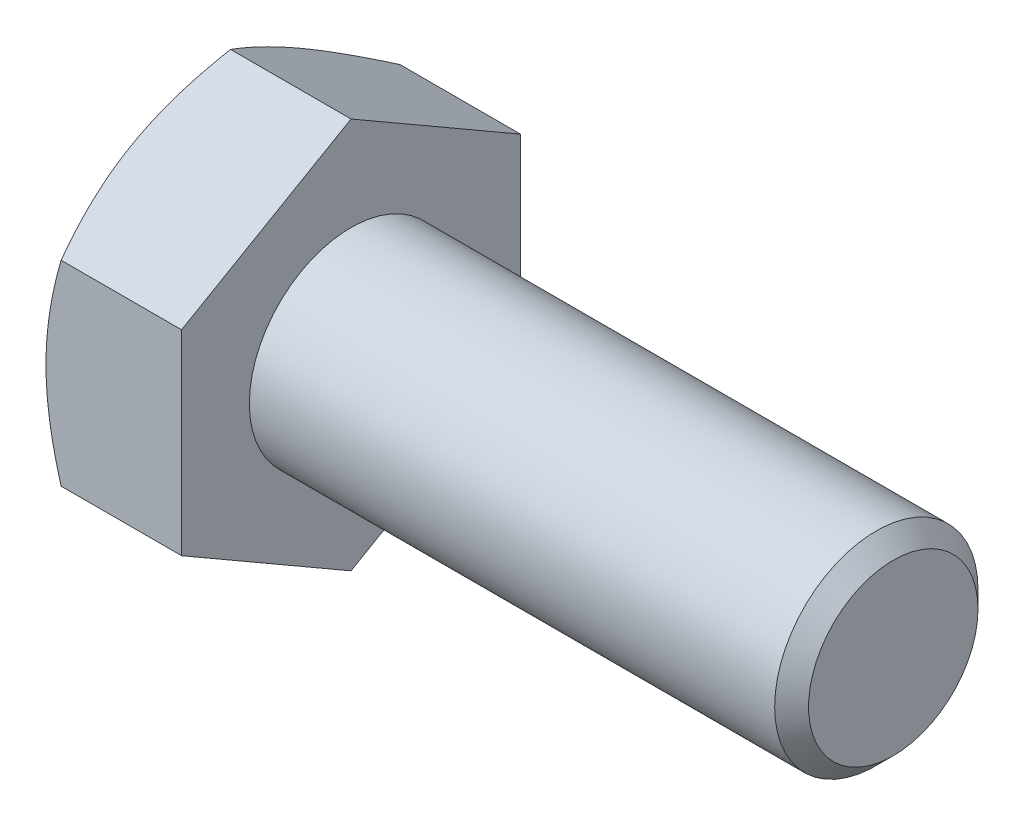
SolidWorks part; units mm, degrees
ref_plane "Face" through (0, 0, 0) normal (0, 0, 1) x (1, 0, 0)
ref_plane "Coté" through (0, 0, 0) normal (0, 1, 0) x (1, 0, 0)
ref_plane "Dessus" through (0, 0, 0) normal (1, 0, 0) x (0, 0, -1)
extrude "Tige" add sketch "E_tige" along normal blind 16
sketch "E_tige" plane through (0, 0, 0) normal (1, 0, 0) x (0, 0, -1)
  circle A0 centre (0, 0) radius 3
  dimension "Diamètre_nominal" = 6
extrude "Tête" add sketch "E_tête" along normal blind 4
sketch "E_tête" plane through (0, 0, 0) normal (-1, 0, 0) x (0, 0, 1)
  line L0 (0, -15.3288) -> (0, 16.0156) construction
  line L1 (19.0127, 0) -> (-20.4488, 0) construction
  line L2 (0, -5.7735) -> (-5, -2.8868)
  line L3 (-5, -2.8868) -> (-5, 2.8868)
  line L4 (-5, 2.8868) -> (0, 5.7735)
  line L5 (5, 2.8868) -> (0, 5.7735)
  line L6 (5, -2.8868) -> (5, 2.8868)
  line L7 (0, -5.7735) -> (5, -2.8868)
  circle A0 centre (0, 0) radius 5.7735 construction
  dimension "Cote_sur_plat" = 10
sketch "E_chanfrein_tête" plane through (-4, 0, 0) normal (-1, 0, 0) x (0, 0, 1)
  line L0 (5, 2.8868) -> (0, 5.7735) construction
  circle A0 centre (0, 0) radius 5
extrude "Chanfrein_tête" cut sketch "E_chanfrein_tête" against normal through all draft 60 flip side to cut
chamfer "Chanfrein1" distance 0.5 angle 45 1 edges at (16, 0, -3)
